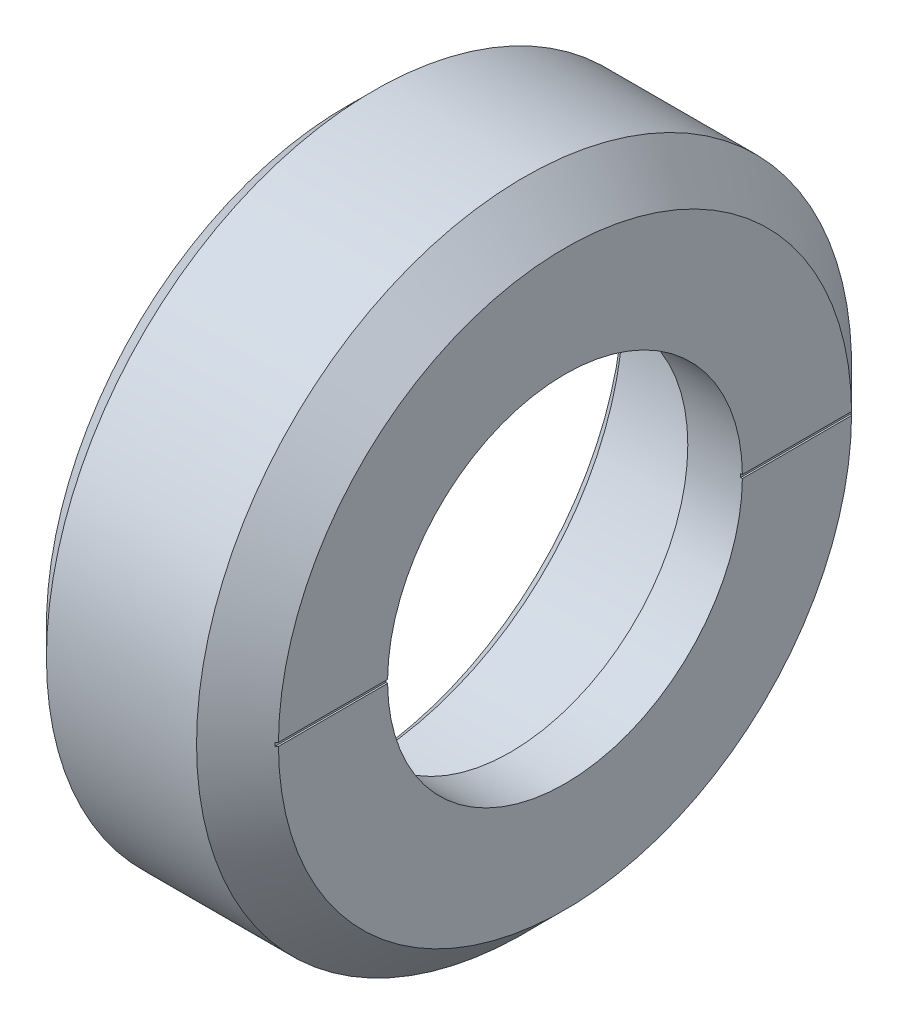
SolidWorks part; units mm, degrees
ref_plane "Plan1" through (0, 0, 0) normal (0, 0, 1) x (1, 0, 0)
ref_plane "Plan2" through (0, 0, 0) normal (0, 1, 0) x (1, 0, 0)
ref_plane "Plan3" through (0, 0, 0) normal (1, 0, 0) x (0, 0, -1)
sketch "Esquisse1" plane through (0, 0, 0) normal (0, 0, 1) x (1, 0, 0)
  line L0 (0, 0) -> (20, 0) construction
  line L1 (0, 19.25) -> (0, 24)
  line L2 (0, 24) -> (16, 24)
  line L3 (16, 24) -> (16, 13)
  line L4 (16, 13) -> (12, 13)
  line L5 (12, 13) -> (12, 20.25)
  line L6 (12, 20.25) -> (11, 20.25)
  line L7 (11, 20.25) -> (11, 19.25)
  line L8 (11, 19.25) -> (0, 19.25)
  dimension "D1" = 24
  dimension "D2" = 13
  dimension "D3" = 19.25
  dimension "D4" = 1
  dimension "D5" = 16
  dimension "D6" = 1
  dimension "D7" = 12
revolve "Base-Révolution" add sketch "Esquisse1"
chamfer "Chanfrein3" distance 1 angle 45
chamfer "Chanfrein1" distance 3 angle 45
chamfer "Chanfrein2" distance 2 angle 45
sketch "Esquisse2" plane through (0, 0, 0) normal (0, 0, 1) x (1, 0, 0)
  line L0 (0, 0) -> (20, 0) construction
  line L1 (16, -21) -> (16, 21) construction
  line L2 (18, 0.125) -> (15.875, 0.125)
  line L3 (18, 0.125) -> (18, -0.125)
  line L4 (18, -0.125) -> (15.875, -0.125)
  line L5 (15.875, 0.125) -> (15.875, -0.125)
  line L6 (16, -21) -> (16, 21) construction
  dimension "D1" = 0.25
  dimension "D2" = 2
  dimension "D3" = 0.25
extrude "Enlèv. mat.-Extru.1" cut sketch "Esquisse2" along normal mid plane 83
